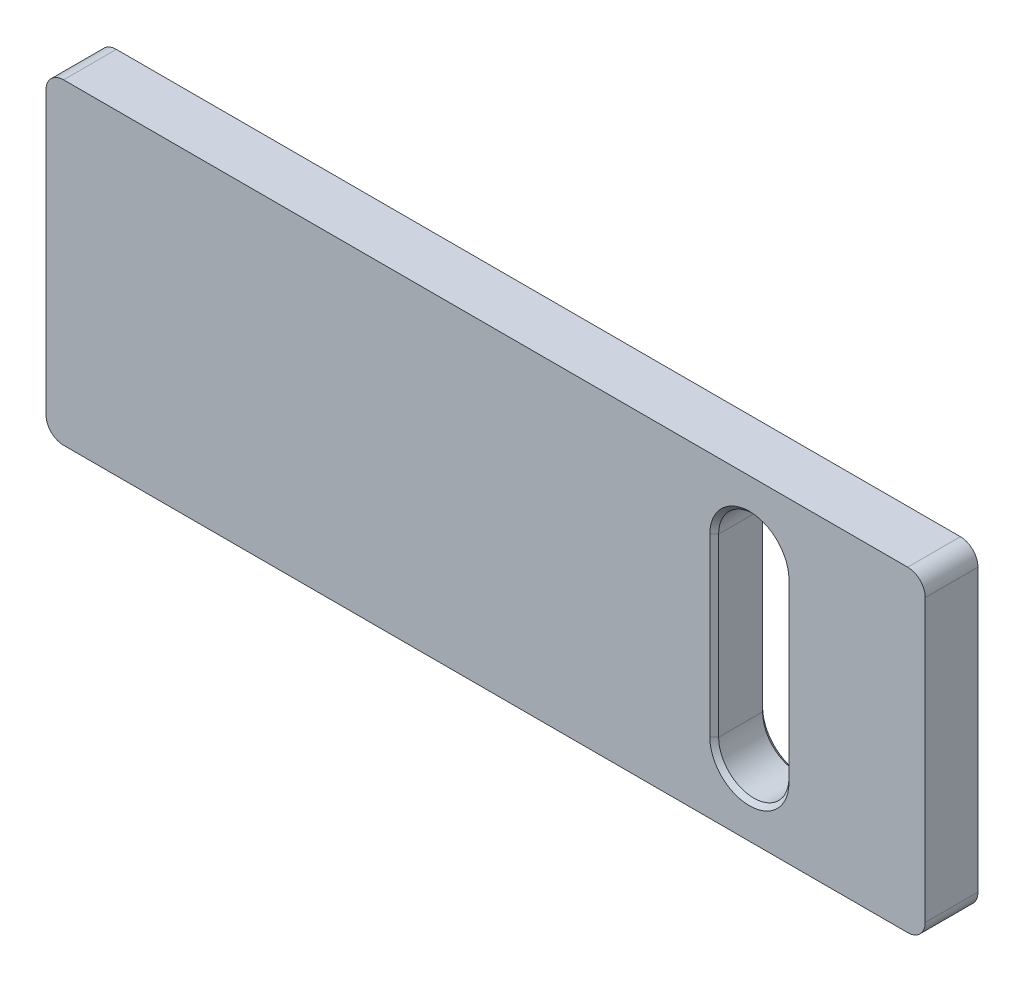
SolidWorks part; units mm, degrees
ref_plane "Front" through (0, 0, 0) normal (0, 0, 1) x (1, 0, 0)
ref_plane "Top" through (0, 0, 0) normal (0, 1, 0) x (1, 0, 0)
ref_plane "Right" through (0, 0, 0) normal (1, 0, 0) x (0, 0, -1)
sketch "Esquisse1" plane through (0, 0, 0) normal (0, 0, 1) x (1, 0, 0)
  line L1 (-25, 9) -> (25, 9)
  line L2 (-25, 9) -> (-25, -9)
  line L3 (-25, -9) -> (25, -9)
  line L4 (25, 9) -> (25, -9)
  line L5 (-25, 9) -> (25, -9) construction
  line L6 (-25, -9) -> (25, 9) construction
  point P0 (0, 0)
  dimension "D1" = 50
  dimension "D2" = 18
extrude "Boss.-Extru.1" add sketch "Esquisse1" along normal blind 3
sketch "Esquisse2" plane through (0, 0, 3) normal (0, 0, 1) x (1, 0, 0)
  line L0 (15, 5) -> (15, -5) construction
  line L1 (17, 5) -> (17, -5)
  line L2 (13, 5) -> (13, -5)
  line L3 (0, 0) -> (25, 0) construction
  line L4 (25, -9) -> (25, 9) construction
  arc A0 (17, 5) -> (13, 5) centre (15, 5) ccw
  arc A1 (13, -5) -> (17, -5) centre (15, -5) ccw
  point P2 (15, 0)
  dimension "D1" = 10
  dimension "D2" = 4
  dimension "D3" = 10
extrude "Enlèv. mat.-Extru.1" cut sketch "Esquisse2" against normal up to next
fillet "Congé1" radius 1 4 edges at (25, -9, 1.5) (-25, -9, 1.5) (25, 9, 1.5) (-25, 9, 1.5)
chamfer "Chanfrein1" distance 0.25 angle 45 8 edges at (13, 0, 0) (15, -7, 0) (17, 0, 0) (15, 7, 0) (15, 7, 3) (13, 0, 3) (15, -7, 3) (17, 0, 3)
ref_plane "Plan1" through (0, 0, 1.5) normal (0, 0, 1) x (1, 0, 0)
sketch "Esquisse3" plane through (-25, 0, 0) normal (-1, 0, 0) x (0, 0, 1)
  line L0 (0, 8) -> (3, -8) construction
  line L1 (3, 8) -> (0, -8) construction
  point P8 (1.5, 0)
